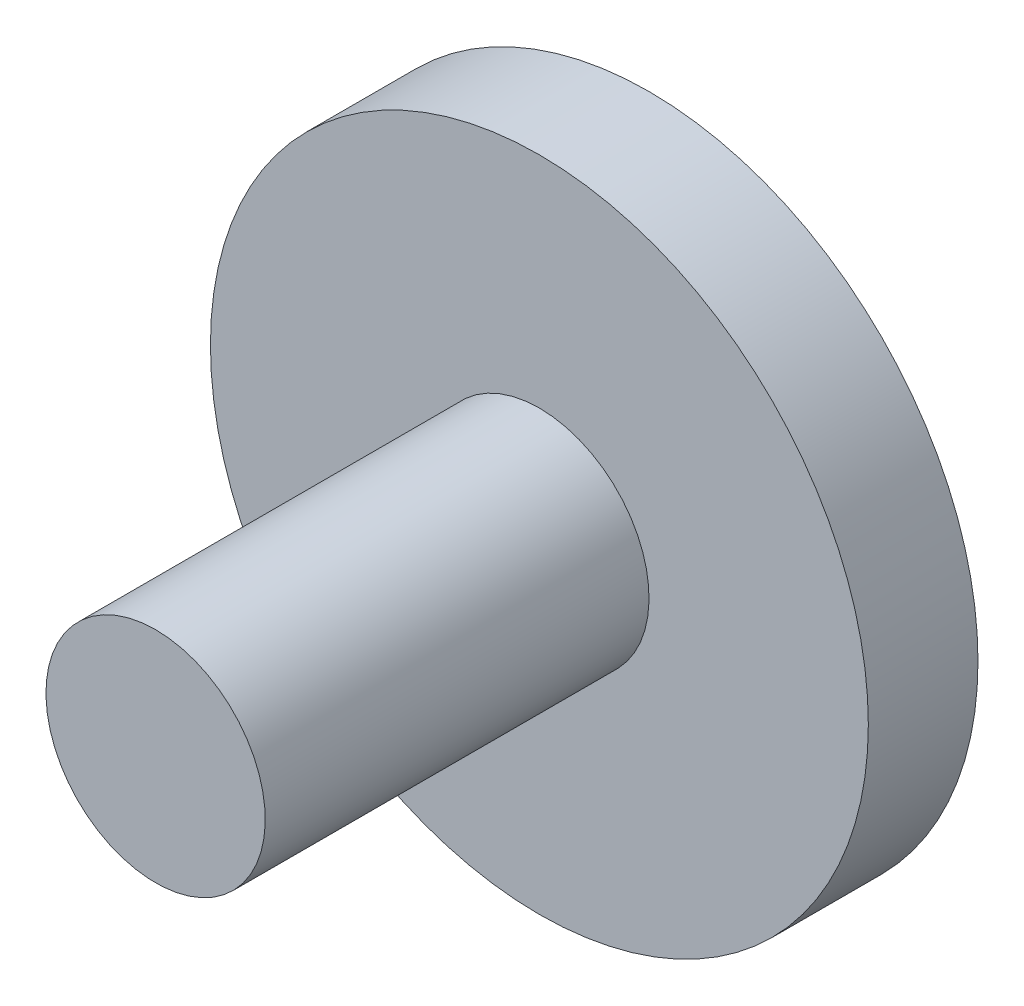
SolidWorks part; units mm, degrees
ref_plane "Front Plane" through (0, 0, 0) normal (0, 0, 1) x (1, 0, 0)
ref_plane "Top Plane" through (0, 0, 0) normal (0, 1, 0) x (1, 0, 0)
ref_plane "Right Plane" through (0, 0, 0) normal (1, 0, 0) x (0, 0, -1)
sketch "Sketch1" plane through (0, 0, 0) normal (1, 0, 0) x (0, 0, -1)
  line L0 (0, 0) -> (0, 10)
  line L1 (0, 10) -> (35, 10)
  line L2 (35, 10) -> (35, 30)
  line L3 (35, 30) -> (45, 30)
  line L4 (45, 30) -> (45, 0)
  line L5 (45, 0) -> (0, 0)
  line L6 (0, 0) -> (0.4436, 0.1109)
  dimension "D1" = 10
  dimension "D2" = 30
  dimension "D3" = 10
  dimension "D4" = 45
revolve "Revolve1" add sketch "Sketch1" angle 360 about L5
